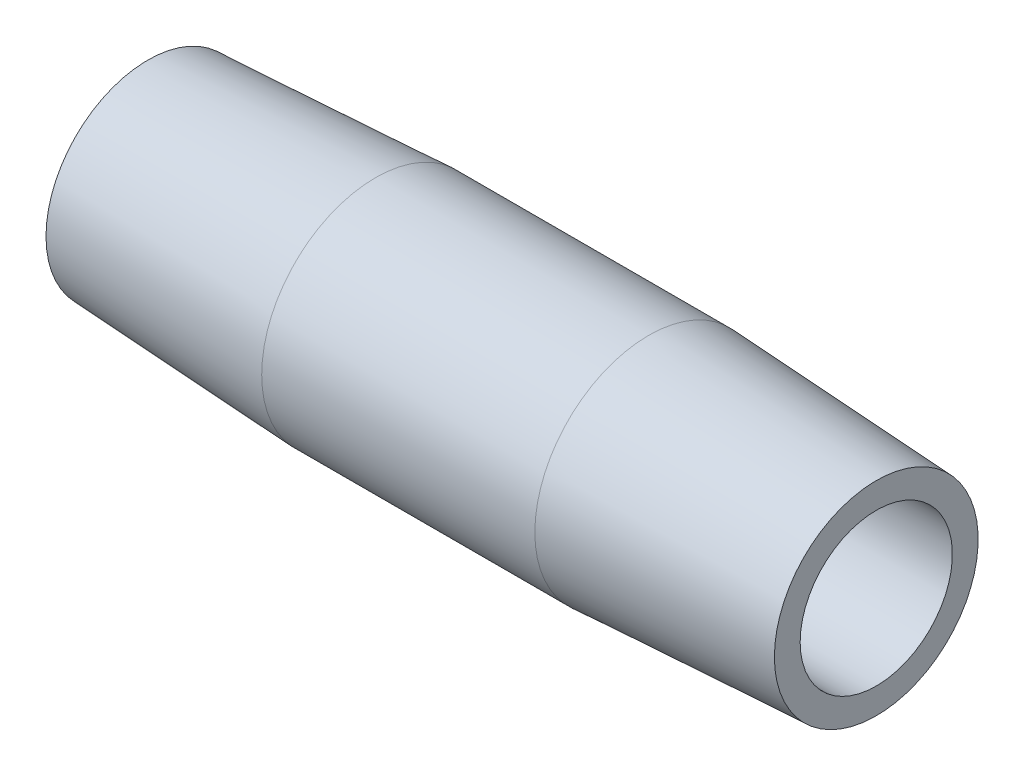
SolidWorks part; units mm, degrees
ref_plane "Front Plane" through (0, 0, 0) normal (0, 0, 1) x (1, 0, 0)
ref_plane "Top Plane" through (0, 0, 0) normal (0, 1, 0) x (1, 0, 0)
ref_plane "Right Plane" through (0, 0, 0) normal (1, 0, 0) x (0, 0, -1)
sketch "Sketch2" plane through (0, 0, 0) normal (0, 0, 1) x (1, 0, 0)
  line L0 (0.4761, 0) -> (50000.4761, 0) construction
  line L1 (0, -11.3625) -> (0, 49988.6375) construction
  line L7 (7.9375, 3.9687) -> (0, 3.5528)
  line L8 (17.4625, 3.9687) -> (7.9375, 3.9687)
  line L9 (25.4, 3.5528) -> (17.4625, 3.9687)
  line L10 (25.4, 2.6543) -> (25.4, 3.5528)
  line L11 (25.4, 2.6543) -> (0, 2.6543)
  line L12 (0, 3.5528) -> (0, 2.6543)
  dimension "D1" = 5.3086
  dimension "D2" = 7.9375
  dimension "D3" = 3
  dimension "D4" = 3
  dimension "D5" = 7.9375
  dimension "D6" = 7.9375
  dimension "D7" = 25.4
revolve "Revolve1" add sketch "Sketch2" angle 360 about L0
